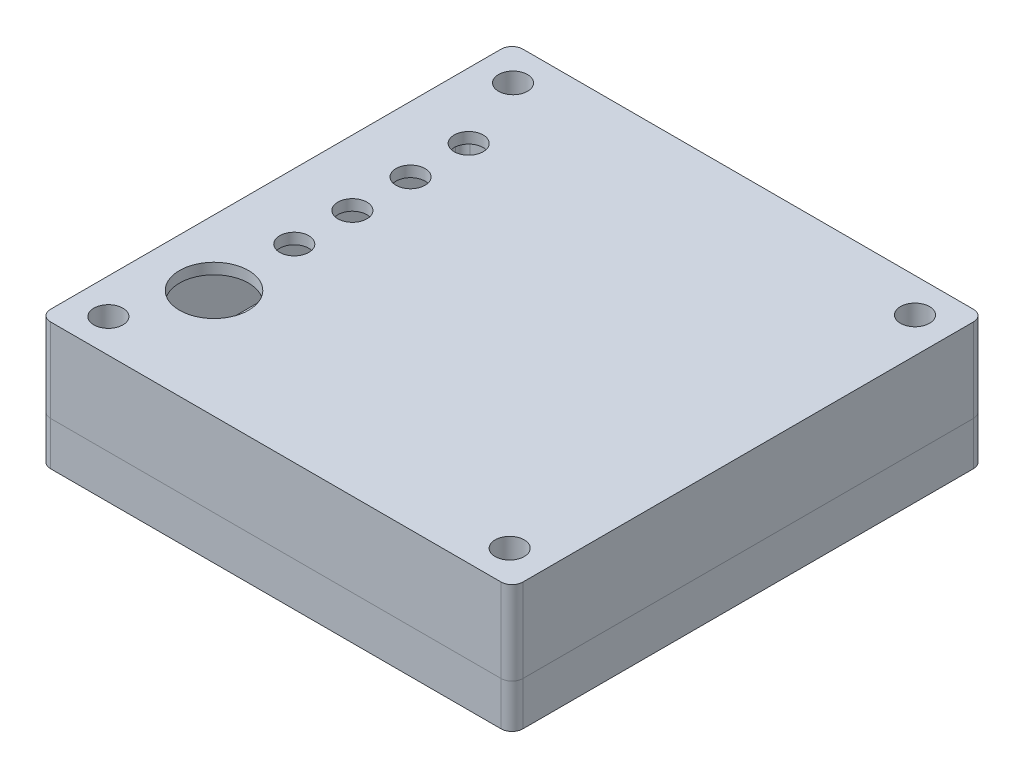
SolidWorks part; units mm, degrees
ref_plane "Plan de face" through (0, 0, 0) normal (0, 0, 1) x (1, 0, 0)
ref_plane "Plan de dessus" through (0, 0, 0) normal (0, 1, 0) x (1, 0, 0)
ref_plane "Plan de droite" through (0, 0, 0) normal (1, 0, 0) x (0, 0, -1)
sketch "Esquisse1" plane through (0, 0, 0) normal (0, 1, 0) x (1, 0, 0)
  line L2 (0, 0) -> (130, 0)
  line L3 (0, 0) -> (0, -130)
  line L4 (0, -130) -> (130, -130)
  line L5 (130, 0) -> (130, -130)
  dimension "D1" = 130
  dimension "D2" = 130
extrude "Extrusion1" add sketch "Esquisse1" along normal blind 23
fillet "Congé1" radius 3 4 edges at (0, 11.5, 0) (0, 11.5, 130) (130, 11.5, 0) (130, 11.5, 130)
sketch "Esquisse2" plane through (0, 0, 0) normal (0, -1, 0) x (1, 0, 0)
  line L0 (19.5, 4) -> (110.5, 4)
  line L1 (112.5, 6) -> (112.5, 14.5)
  line L2 (115.5, 17.5) -> (124, 17.5)
  line L3 (126, 19.5) -> (126, 110.5)
  line L4 (124, 112.5) -> (115.5, 112.5)
  line L5 (112.5, 115.5) -> (112.5, 124)
  line L6 (110.5, 126) -> (19.5, 126)
  line L7 (17.5, 124) -> (17.5, 115.5)
  line L8 (14.5, 112.5) -> (6, 112.5)
  line L9 (4, 110.5) -> (4, 19.5)
  line L10 (6, 17.5) -> (14.5, 17.5)
  line L11 (17.5, 14.5) -> (17.5, 6)
  line L12 (127, 0) -> (3, 0) construction
  line L13 (0, 3) -> (0, 127) construction
  line L14 (3, 130) -> (127, 130) construction
  line L15 (130, 127) -> (130, 3) construction
  arc A0 (112.5, 14.5) -> (115.5, 17.5) centre (115.5, 14.5) cw
  arc A1 (14.5, 17.5) -> (17.5, 14.5) centre (14.5, 14.5) cw
  arc A2 (17.5, 115.5) -> (14.5, 112.5) centre (14.5, 115.5) cw
  arc A3 (115.5, 112.5) -> (112.5, 115.5) centre (115.5, 115.5) cw
  arc A4 (110.5, 4) -> (112.5, 6) centre (110.5, 6) ccw
  arc A5 (124, 17.5) -> (126, 19.5) centre (124, 19.5) ccw
  arc A6 (126, 110.5) -> (124, 112.5) centre (124, 110.5) ccw
  arc A7 (112.5, 124) -> (110.5, 126) centre (110.5, 124) ccw
  arc A8 (6, 112.5) -> (4, 110.5) centre (6, 110.5) ccw
  arc A9 (19.5, 126) -> (17.5, 124) centre (19.5, 124) ccw
  arc A10 (4, 19.5) -> (6, 17.5) centre (6, 19.5) ccw
  arc A11 (19.5, 4) -> (17.5, 6) centre (19.5, 6) cw
  point P30 (112.5, 4)
  point P33 (126, 17.5)
  point P36 (126, 112.5)
  point P39 (112.5, 126)
  point P42 (4, 112.5)
  point P45 (17.5, 126)
  point P48 (4, 17.5)
  point P51 (17.5, 4)
  dimension "D13" = 3
  dimension "D14" = 2
  dimension "D1" = 4
  dimension "D2" = 4
  dimension "D3" = 4
  dimension "D4" = 4
  dimension "D5" = 95
  dimension "D6" = 95
  dimension "D7" = 95
  dimension "D8" = 95
  dimension "D9" = 17.5
  dimension "D10" = 17.5
  dimension "D11" = 17.5
  dimension "D12" = 17.5
extrude "Extrusion2" cut sketch "Esquisse2" against normal blind 20
sketch "Esquisse3" plane through (0, 0, 0) normal (0, -1, 0) x (1, 0, 0)
  circle A0 centre (9.6931, 9.4114) radius 4
  arc A1 (17.5, 14.5) -> (14.5, 17.5) centre (14.5, 14.5) ccw construction
  circle A2 centre (120.2998, 9.4047) radius 4
  arc A3 (115.5, 17.5) -> (112.5, 14.5) centre (115.5, 14.5) ccw construction
  circle A4 centre (120.1202, 120.7587) radius 4
  arc A5 (112.5, 115.5) -> (115.5, 112.5) centre (115.5, 115.5) ccw construction
  circle A6 centre (9.6931, 120.7587) radius 4
  dimension "D1" = 7
  dimension "D2" = 7
  dimension "D3" = 7
extrude "Extrusion3" cut sketch "Esquisse3" against normal blind 23
sketch "Esquisse4" plane through (0, 23, 0) normal (0, 1, 0) x (-1, 0, 0)
  line L0 (0, 3) -> (0, 127) construction
  line L1 (-3, 130) -> (-127, 130) construction
  circle A0 centre (-18, 29.9163) radius 4
  circle A1 centre (-18, 45.9163) radius 4
  circle A2 centre (-18, 61.9163) radius 4
  circle A3 centre (-18, 77.9163) radius 4
  circle A4 centre (-18, 100) radius 6.25
  dimension "D1" = 8
  dimension "D2" = 18
  dimension "D3" = 12.5
  dimension "D4" = 30
  dimension "D5" = 16
  dimension "D6" = 16
  dimension "D7" = 16
  dimension "D8" = 18
extrude "Extrusion4" cut sketch "Esquisse4" against normal blind 3
sketch "Esquisse6" plane through (0, 20, 0) normal (0, -1, 0) x (1, 0, 0)
  line L0 (110.5, 126) -> (19.5, 126) construction
  line L1 (126, 19.5) -> (126, 110.5) construction
  circle A0 centre (103.5, 111) radius 5
  circle A1 centre (63.5, 111) radius 5
  circle A2 centre (23.5, 111) radius 5
  circle A3 centre (103.5, 66) radius 5
  circle A6 centre (103.5, 21) radius 5
  circle A7 centre (63.5, 21) radius 5
  circle A8 centre (23.5, 21) radius 5
  circle A9 centre (23.5, 66) radius 5
  circle A10 centre (63.5, 66) radius 5
  dimension "D1" = 15
  dimension "D2" = 22.5
extrude "Extrusion6" cut sketch "Esquisse6" against normal blind 1.5
sketch "Esquisse7" plane through (0, 21.5, 0) normal (0, -1, 0) x (1, 0, 0)
  circle A0 centre (103.5, 111) radius 3
  circle A1 centre (63.5, 111) radius 3
  circle A2 centre (23.5, 111) radius 3
  circle A3 centre (103.5, 66) radius 3
  circle A6 centre (103.5, 21) radius 3
  circle A7 centre (63.5, 21) radius 3
  circle A8 centre (23.5, 21) radius 3
  circle A9 centre (63.5, 66) radius 3
  circle A10 centre (23.5, 66) radius 3
extrude "Extrusion7" add sketch "Esquisse7" along normal blind 6.5
sketch "Esquisse8" plane through (0, 15, 0) normal (0, -1, 0) x (1, 0, 0)
  circle A0 centre (63.5, 111) radius 1
  circle A1 centre (103.5, 111) radius 1
  circle A3 centre (103.5, 66) radius 1
  circle A4 centre (63.5, 21) radius 1
  circle A5 centre (103.5, 21) radius 1
  circle A6 centre (23.5, 111) radius 1
  circle A7 centre (23.5, 21) radius 1
  circle A8 centre (63.5, 66) radius 1
extrude "Extrusion8" cut sketch "Esquisse8" against normal blind 3
fillet "Congé2" radius 1 14 edges at (23.5, 15, 108) (23.5, 15, 110) (103.5, 15, 110) (103.5, 15, 108) (63.5, 15, 108) (63.5, 15, 110) (103.5, 15, 65) (103.5, 15, 63) (63.5, 15, 18) (103.5, 15, 18) (103.5, 15, 20) (63.5, 15, 20) (23.5, 15, 18) (23.5, 15, 20)
sketch "Esquisse11" plane through (0, 0, 0) normal (0, -1, 0) x (1, 0, 0)
  line L4 (0, 127) -> (0, 3)
  line L5 (3, 0) -> (127, 0)
  line L6 (130, 3) -> (130, 127)
  line L7 (127, 130) -> (3, 130)
  line L8 (0, 127) -> (0, 3)
  line L9 (3, 0) -> (127, 0)
  line L10 (130, 3) -> (130, 127)
  line L11 (127, 130) -> (3, 130)
  arc A4 (0, 3) -> (3, 0) centre (3, 3) ccw
  arc A5 (127, 0) -> (130, 3) centre (127, 3) ccw
  arc A6 (130, 127) -> (127, 130) centre (127, 127) ccw
  arc A7 (3, 130) -> (0, 127) centre (3, 127) ccw
  arc A8 (0, 3) -> (3, 0) centre (3, 3) ccw
  arc A9 (127, 0) -> (130, 3) centre (127, 3) ccw
  arc A10 (130, 127) -> (127, 130) centre (127, 127) ccw
  arc A11 (3, 130) -> (0, 127) centre (3, 127) ccw
  dimension "D1" = 0
extrude "Extrusion11" add sketch "Esquisse11" along normal blind 12 separate body
sketch "Esquisse12" plane through (0, 0, 0) normal (0, 0, -1) x (-1, 0, 0)
  line L0 (0, 23) -> (0, 0) construction
  line L1 (-3, 0) -> (-127, 0) construction
  line L2 (-130, 0) -> (-130, 23) construction
  line L3 (-127, 0) -> (-3, 0) construction
  circle A0 centre (-26.5, 11) radius 6.5
  circle A1 centre (-103.5, 8) radius 4
  dimension "D3" = 13
  dimension "D4" = 8
  dimension "D1" = 26.5
  dimension "D2" = 11
  dimension "D5" = 26.5
  dimension "D6" = 8
extrude "Extrusion12" cut sketch "Esquisse12" against normal blind 10
sketch "Esquisse13" plane through (0, 23, 0) normal (0, 1, 0) x (-1, 0, 0)
  circle A0 centre (-18, 100) radius 9.5
  dimension "D1" = 19
extrude "Extrusion13" cut sketch "Esquisse13" against normal blind 10
